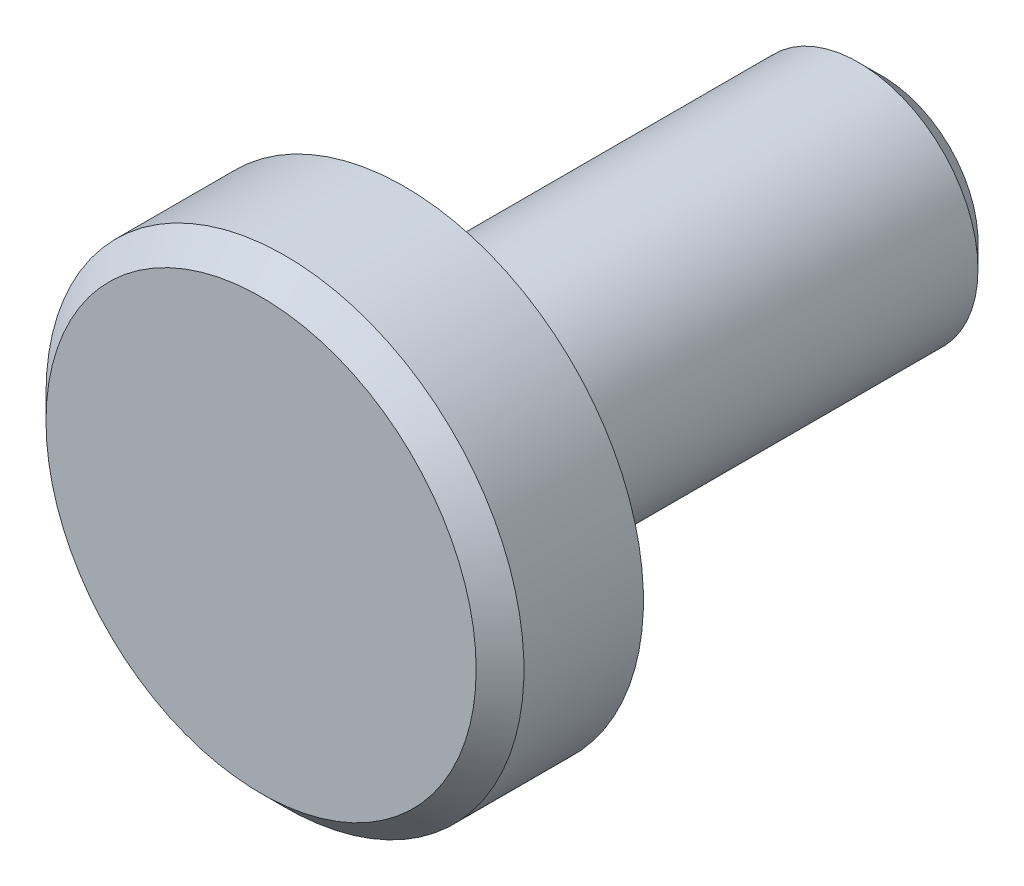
SolidWorks part; units mm, degrees
ref_plane "Plane1" through (0, 0, 0) normal (0, 0, 1) x (1, 0, 0)
ref_plane "Plane2" through (0, 0, 0) normal (0, 1, 0) x (1, 0, 0)
ref_plane "Plane3" through (0, 0, 0) normal (1, 0, 0) x (0, 0, -1)
sketch "Sketch1" plane through (0, 0, 0) normal (0, 0, 1) x (1, 0, 0)
  circle A0 centre (0, 0) radius 7.9375
  dimension "D1" = 15.875
extrude "Base-Extrude" add sketch "Sketch1" along normal blind 4.7625
sketch "Sketch2" plane through (0, 0, 0) normal (0, 0, -1) x (-1, 0, 0)
  circle A0 centre (0, 0) radius 3.9688
  dimension "D1" = 7.9375
extrude "Boss-Extrude1" add sketch "Sketch2" along normal blind 15.875
chamfer "Chamfer1" distance 0.7937 angle 45 2 edges at (7.9375, 0, 4.7625) (-3.9688, 0, -15.875)
